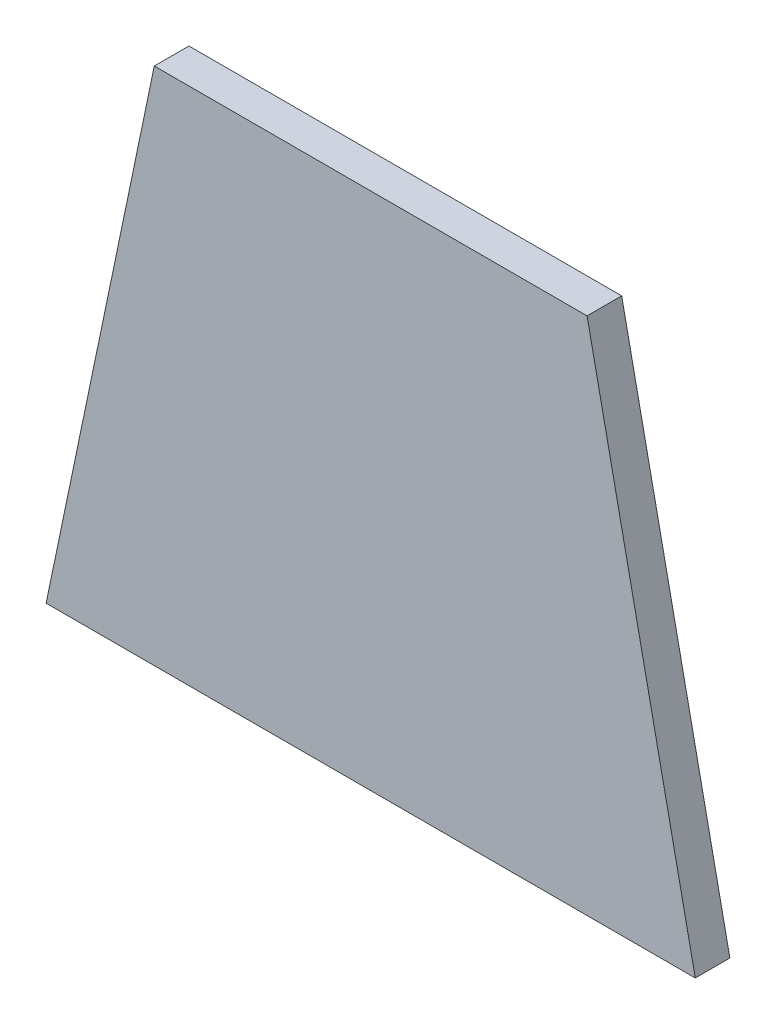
SolidWorks part; units mm, degrees
ref_plane "Face" through (0, 0, 0) normal (0, 0, 1) x (1, 0, 0)
ref_plane "Dessus" through (0, 0, 0) normal (0, 1, 0) x (1, 0, 0)
ref_plane "Droite" through (0, 0, 0) normal (1, 0, 0) x (0, 0, -1)
sketch "Esquisse1" plane through (0, 0, 0) normal (0, 0, 1) x (1, 0, 0)
  line L0 (0, 0) -> (25, 120)
  line L1 (25, 120) -> (125, 120)
  line L2 (125, 120) -> (150, 0)
  line L3 (150, 0) -> (0, 0)
  dimension "D1" = 150
  dimension "D2" = 100
  dimension "D3" = 25
  dimension "D4" = 120
extrude "Base-Extrusion" add sketch "Esquisse1" along normal blind 8
